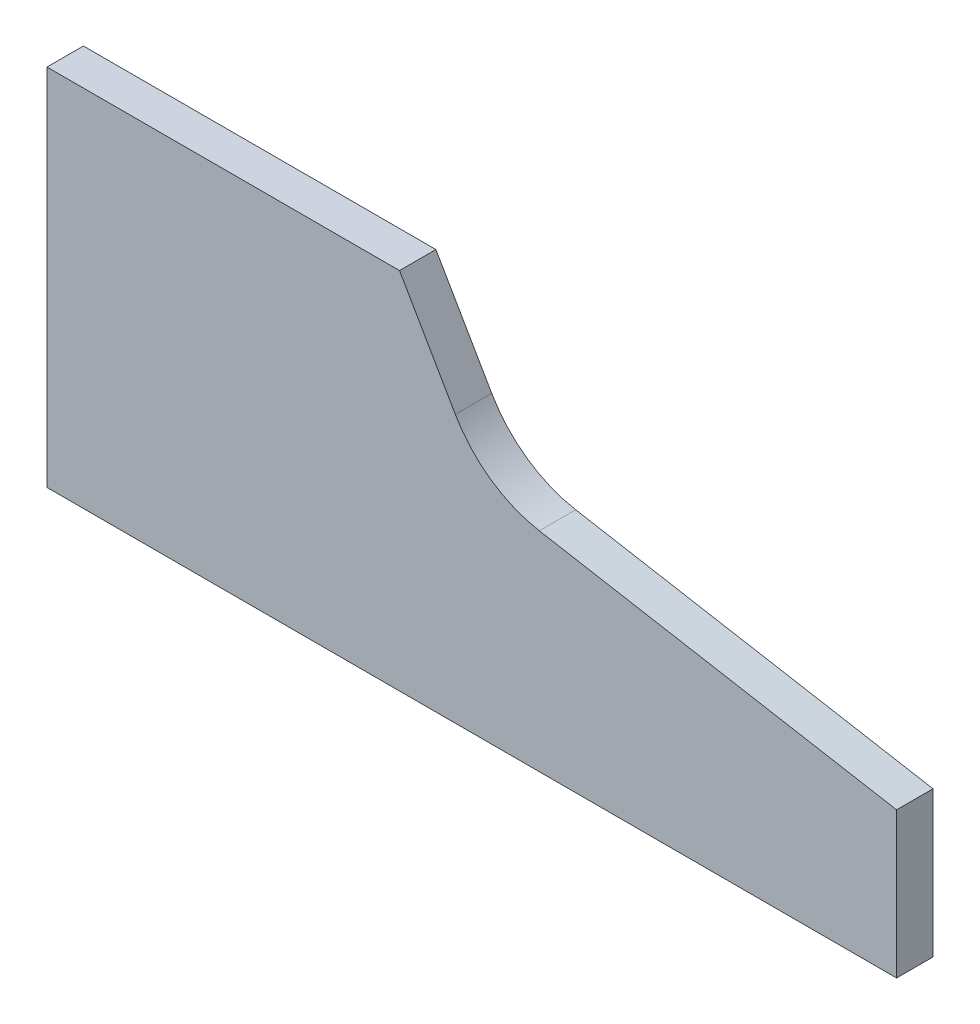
SolidWorks part; units mm, degrees
ref_plane "Front" through (0, 0, 0) normal (0, 0, 1) x (1, 0, 0)
ref_plane "Top" through (0, 0, 0) normal (0, 1, 0) x (1, 0, 0)
ref_plane "Right" through (0, 0, 0) normal (1, 0, 0) x (0, 0, -1)
sketch "Skizze1" plane through (0, 0, 0) normal (0, 0, 1) x (1, 0, 0)
  line L0 (0, 0) -> (0, 30)
  line L1 (0, 30) -> (29.0441, 30)
  line L2 (29.0441, 30) -> (33.6408, 22.0383)
  line L3 (40.5645, 17.1903) -> (70, 12)
  line L4 (70, 12) -> (70, 0)
  line L5 (70, 0) -> (0, 0)
  arc A0 (40.5645, 17.1903) -> (33.6408, 22.0383) centre (42.301, 27.0383) cw
  point P9 (35.9723, 18)
  dimension "D7" = 10
  dimension "D1" = 18
  dimension "D2" = 70
  dimension "D3" = 30
  dimension "D4" = 60
  dimension "D5" = 80
  dimension "D6" = 12
extrude "Aufsatz-Linear austragen1" add sketch "Skizze1" along normal mid plane 3
